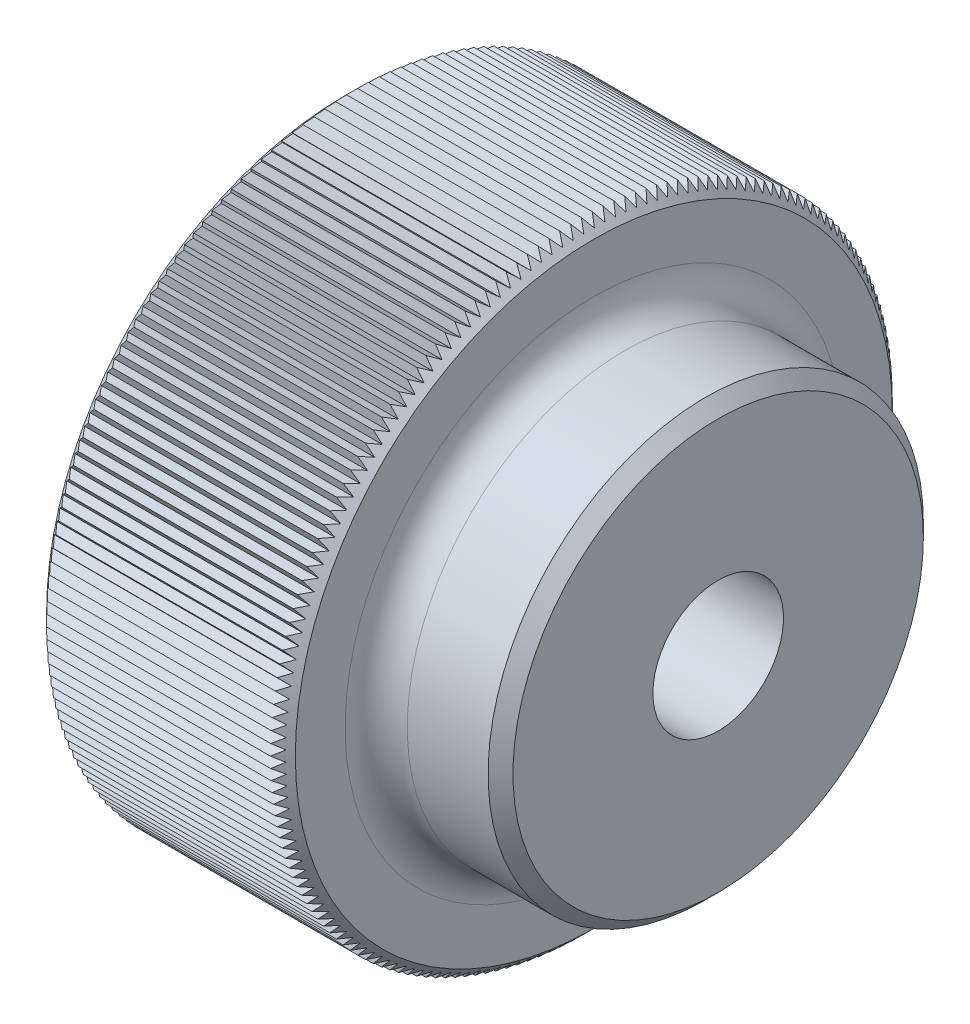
SolidWorks part; units mm, degrees
ref_plane "Front Plane" through (0, 0, 0) normal (0, 0, 1) x (1, 0, 0)
ref_plane "Top Plane" through (0, 0, 0) normal (0, 1, 0) x (1, 0, 0)
ref_plane "Right Plane" through (0, 0, 0) normal (1, 0, 0) x (0, 0, -1)
sketch "Sketch1" plane through (0, 0, 0) normal (1, 0, 0) x (0, 0, -1)
  circle A0 centre (0, 0) radius 10
  dimension "D1" = 20
extrude "Extrude1" add sketch "Sketch1" against normal blind 8
chamfer "Chamfer1" distance 0.4 angle 45 2 edges at (-8, 0, -10) (0, 0, -10)
sketch "Sketch2" plane through (0, 0, 0) normal (1, 0, 0) x (0, 0, -1)
  line L0 (0, 0) -> (0, 50000) construction
  line L1 (0, 0) -> (-872.6203, 49992.3848) construction
  line L2 (0, 10) -> (-0.1702, 9.75)
  line L3 (-0.349, 9.9939) -> (-0.1702, 9.75)
  circle A0 centre (0, 0) radius 10 construction
  arc A1 (-0.349, 9.9939) -> (0, 10) centre (-0.1766, 10.1203) cw
  dimension "D1" = 1
  dimension "D2" = 0.25
extrude "Extrude2" cut sketch "Sketch2" against normal through all
pattern_circular "CirPattern1" count 180 over 360 about axis through (0, 0, 0) along (1, 0, 0) of "Extrude2"
sketch "Sketch3" plane through (0, 0, 0) normal (1, 0, 0) x (0, 0, -1)
  circle A0 centre (0, 0) radius 7
  dimension "D1" = 14
extrude "Extrude3" add sketch "Sketch3" along normal blind 4
fillet "Fillet1" radius 1 1 edges at (0, 0, -7)
sketch "Sketch4" plane through (-8, 0, 0) normal (-1, 0, 0) x (0, 0, 1)
  circle A0 centre (0, 0) radius 2.1
  dimension "D1" = 4.2
extrude "Extrude4" cut sketch "Sketch4" against normal through all
sketch "Sketch5" plane through (-8, 0, 0) normal (-1, 0, 0) x (0, 0, 1)
  circle A0 centre (0, 0) radius 7.5
  dimension "D1" = 15
extrude "Extrude5" cut sketch "Sketch5" against normal blind 5
chamfer "Chamfer2" distance 0.4 angle 45 3 edges at (-8, 0, 7.5) (4, 0, -7) (-3, 0, 2.1)
sketch "Sketch6" plane through (0, 0, 0) normal (0, 0, 1) x (1, 0, 0)
  line L0 (4, -6.6) -> (4, 6.6) construction
  circle A0 centre (1.5, 0) radius 0.7
  dimension "D1" = 1.4
  dimension "D2" = 2.5
extrude "Extrude6" [suppressed] cut sketch "Sketch6" along normal through all
